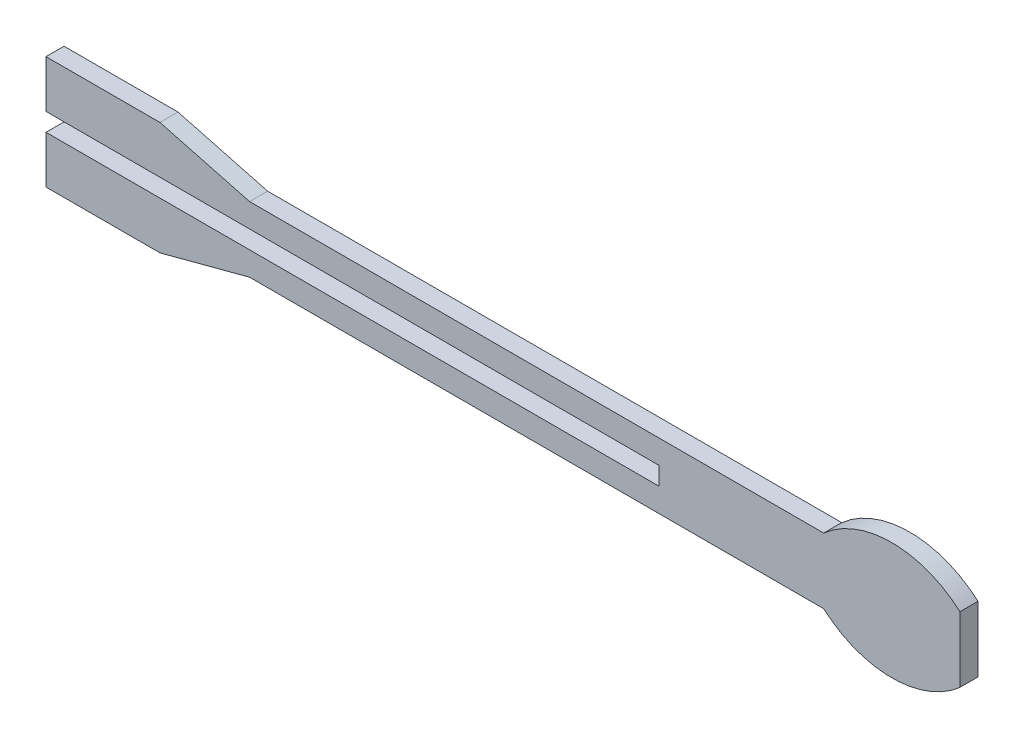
SolidWorks part; units mm, degrees
ref_plane "Front Plane" through (0, 0, 0) normal (0, 0, 1) x (1, 0, 0)
ref_plane "Top Plane" through (0, 0, 0) normal (0, 1, 0) x (1, 0, 0)
ref_plane "Right Plane" through (0, 0, 0) normal (1, 0, 0) x (0, 0, -1)
sketch "Sketch1" plane through (0, 0, 0) normal (0, 0, 1) x (1, 0, 0)
  line L0 (50.1353, -1.524) -> (-1.6384, -1.524)
  line L1 (50.1353, -1.524) -> (50.1353, 0)
  line L2 (50.1353, 0) -> (-1.6384, 0)
  line L3 (-1.6384, -1.524) -> (-1.6384, -5.5315)
  line L4 (-1.6384, -5.5315) -> (7.98, -5.5315)
  line L5 (7.98, -5.5315) -> (15.5534, -3.5278)
  line L6 (15.5534, -3.5278) -> (64.0278, -3.5278)
  line L7 (75.5353, -3.5278) -> (75.5353, 2.0038)
  line L8 (75.5353, -0.762) -> (83.831, -0.762) construction
  line L9 (15.5534, 2.0038) -> (64.0278, 2.0038)
  line L10 (7.98, 4.0075) -> (15.5534, 2.0038)
  line L11 (-1.6384, 4.0075) -> (7.98, 4.0075)
  line L12 (-1.6384, 0) -> (-1.6384, 4.0075)
  arc A0 (75.5353, -3.5278) -> (64.0278, -3.5278) centre (69.7816, 2.9646) cw
  arc A1 (75.5353, 2.0038) -> (64.0278, 2.0038) centre (69.7816, -4.4886) ccw
  dimension "D1" = 25.4
extrude "Boss-Extrude1" add sketch "Sketch1" along normal blind 1.524
